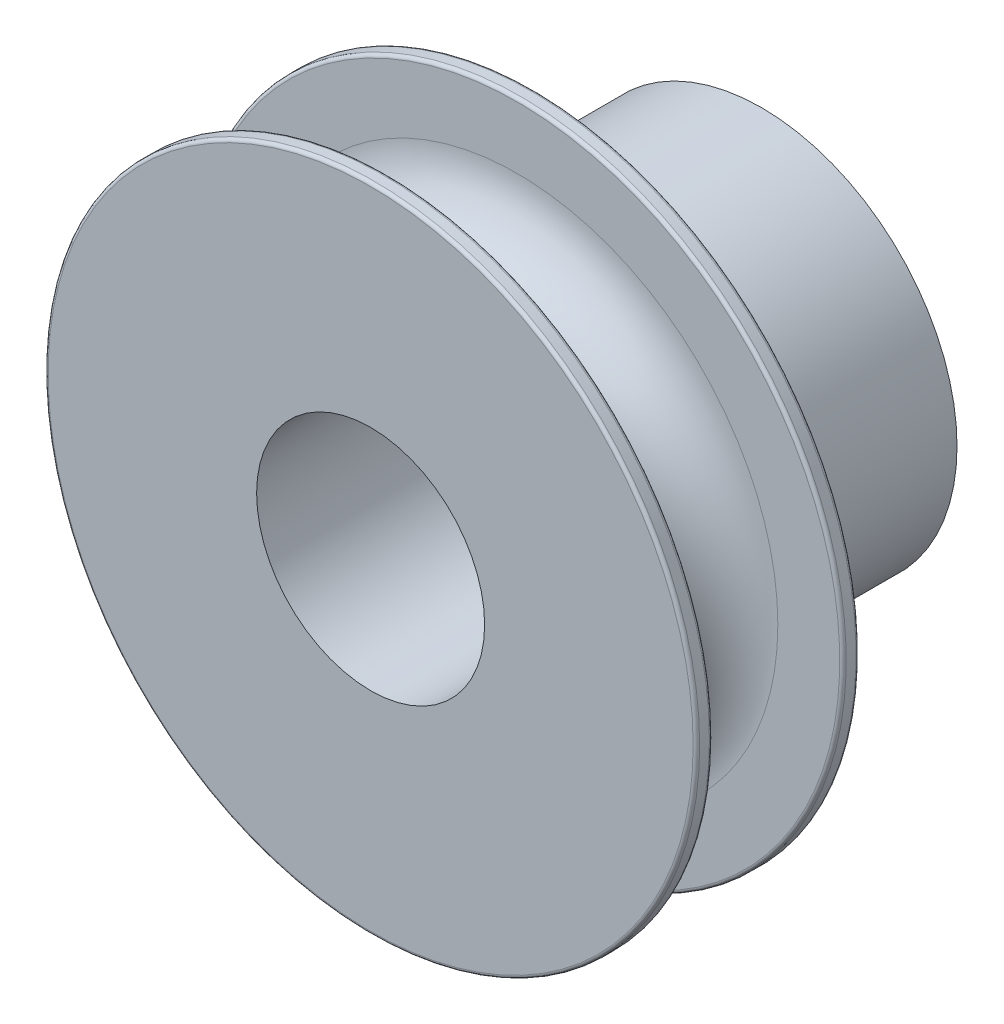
SolidWorks part; units mm, degrees
ref_plane "Front Plane" through (0, 0, 0) normal (0, 0, 1) x (1, 0, 0)
ref_plane "Top Plane" through (0, 0, 0) normal (0, 1, 0) x (1, 0, 0)
ref_plane "Right Plane" through (0, 0, 0) normal (1, 0, 0) x (0, 0, -1)
sketch "Sketch1" plane through (0, 0, 0) normal (0, 0, 1) x (1, 0, 0)
  line L0 (0, 0) -> (0, 19.05) construction
  line L1 (-6.1226, 21.2784) -> (6.1226, 16.8216) construction
  circle A0 centre (0, 0) radius 17.0656 construction
  circle A1 centre (0, 0) radius 20.6375 construction
  circle A2 centre (0, 0) radius 19.05 construction
  circle A3 centre (0, 0) radius 17.9011 construction
  point P8 (203.2, 0)
  point P13 (304.8, 0)
sketch "Sketch2" plane through (0, 0, 0) normal (1, 0, 0) x (0, 0, -1)
  line L0 (-152.4, 0) -> (152.4, 0) construction
  point P2 (-131.7625, 0)
  point P5 (-121.4438, 0)
  point P6 (131.7625, 0)
sketch "Sketch3" plane through (0, 0, 0) normal (0, 0, 1) x (1, 0, 0)
  circle A0 centre (0, 0) radius 20.6375
  circle A1 centre (0, 0) radius 20.6375 construction
extrude "Boss-Extrude1" add sketch "Sketch3" against normal up to vertex and the other way up to vertex
sketch "Sketch4" plane through (0, 0, 0) normal (0, 0, 1) x (1, 0, 0)
  line L0 (0, 0) -> (17.0438, 0.8622) construction
  line L2 (0, 0) -> (17.0438, -0.8622) construction
  line L4 (17.0438, 0.8622) -> (17.8783, 0.9044)
  line L5 (17.8783, -0.9044) -> (17.0438, -0.8622)
  arc A0 (17.0438, 0.8622) -> (17.0438, -0.8622) centre (0, 0) cw
  arc A3 (20.5273, 2.1297) -> (20.5273, -2.1297) centre (0, 0) cw
  circle A4 centre (0, 0) radius 20.6375 construction
  spline S0 degree 4 poles (17.8783, 0.9044) (17.8826, 0.9047) (17.8948, 0.9056) (17.9178, 0.908) (17.9552, 0.9129) (18.0028, 0.9204) (18.0642, 0.9316) (18.1363, 0.9468) (18.2153, 0.9656) (18.3009, 0.9883) (18.3861, 1.013) (18.4708, 1.0393) (18.5549, 1.0673) (18.6565, 1.1031) (18.7778, 1.1487) (18.9188, 1.2059) (19.0779, 1.2755) (19.2391, 1.3513) (19.3967, 1.43) (19.555, 1.5141) (19.7073, 1.5988) (19.8644, 1.6914) (20.0088, 1.7793) (20.1693, 1.883) (20.2983, 1.9682) (20.4671, 2.0861) (20.5663, 2.1574) (20.6818, 2.2427) (20.7328, 2.2815) (20.7642, 2.3054) knots 0 0 0 0 0 0.005377 0.015084 0.028532 0.04661 0.064855 0.092111 0.119476 0.146842 0.174209 0.201575 0.228941 0.256307 0.307035 0.361767 0.4165 0.471232 0.525964 0.580697 0.635429 0.690161 0.744894 0.799626 0.854358 0.909091 0.954545 1 1 1 1 1 construction
  spline S1 degree 4 poles (17.8783, 0.9044) (17.8826, 0.9047) (17.8948, 0.9056) (17.9178, 0.908) (17.9552, 0.9129) (18.0028, 0.9204) (18.0642, 0.9316) (18.1363, 0.9468) (18.2153, 0.9656) (18.3009, 0.9883) (18.3861, 1.013) (18.4708, 1.0393) (18.5549, 1.0673) (18.6565, 1.1031) (18.7778, 1.1487) (18.9188, 1.2059) (19.0779, 1.2755) (19.2391, 1.3513) (19.3967, 1.43) (19.555, 1.5141) (19.7073, 1.5988) (19.8644, 1.6914) (20.0088, 1.7793) (20.1693, 1.883) (20.2983, 1.9682) (20.4305, 2.0606) (20.4946, 2.1061) (20.5273, 2.1297) knots 0 0 0 0 0 0.005377 0.015084 0.028532 0.04661 0.064855 0.092111 0.119476 0.146842 0.174209 0.201575 0.228941 0.256307 0.307035 0.361767 0.4165 0.471232 0.525964 0.580697 0.635429 0.690161 0.744894 0.799626 0.854358 0.909091 0.909091 0.909091 0.909091 0.909091
  spline S2 degree 4 poles (17.8783, -0.9044) (17.8826, -0.9047) (17.8948, -0.9056) (17.9178, -0.908) (17.9552, -0.9129) (18.0028, -0.9204) (18.0642, -0.9316) (18.1363, -0.9468) (18.2153, -0.9656) (18.3009, -0.9883) (18.3861, -1.013) (18.4708, -1.0393) (18.5549, -1.0673) (18.6565, -1.1031) (18.7778, -1.1487) (18.9188, -1.2059) (19.0779, -1.2755) (19.2391, -1.3513) (19.3967, -1.43) (19.555, -1.5141) (19.7073, -1.5988) (19.8644, -1.6914) (20.0088, -1.7793) (20.1693, -1.883) (20.2983, -1.9682) (20.4671, -2.0861) (20.5663, -2.1574) (20.6818, -2.2427) (20.7328, -2.2815) (20.7642, -2.3054) knots 0 0 0 0 0 0.005377 0.015084 0.028532 0.04661 0.064855 0.092111 0.119476 0.146842 0.174209 0.201575 0.228941 0.256307 0.307035 0.361767 0.4165 0.471232 0.525964 0.580697 0.635429 0.690161 0.744894 0.799626 0.854358 0.909091 0.954545 1 1 1 1 1 construction
  spline S3 degree 4 poles (17.8783, -0.9044) (17.8826, -0.9047) (17.8948, -0.9056) (17.9178, -0.908) (17.9552, -0.9129) (18.0028, -0.9204) (18.0642, -0.9316) (18.1363, -0.9468) (18.2153, -0.9656) (18.3009, -0.9883) (18.3861, -1.013) (18.4708, -1.0393) (18.5549, -1.0673) (18.6565, -1.1031) (18.7778, -1.1487) (18.9188, -1.2059) (19.0779, -1.2755) (19.2391, -1.3513) (19.3967, -1.43) (19.555, -1.5141) (19.7073, -1.5988) (19.8644, -1.6914) (20.0088, -1.7793) (20.1693, -1.883) (20.2983, -1.9682) (20.4305, -2.0606) (20.4946, -2.1061) (20.5273, -2.1297) knots 0 0 0 0 0 0.005377 0.015084 0.028532 0.04661 0.064855 0.092111 0.119476 0.146842 0.174209 0.201575 0.228941 0.256307 0.307035 0.361767 0.4165 0.471232 0.525964 0.580697 0.635429 0.690161 0.744894 0.799626 0.854358 0.909091 0.909091 0.909091 0.909091 0.909091
extrude "Cut-Extrude1" cut sketch "Sketch4" against normal through all both and the other way through all
fillet "Fillet1" radius 0.5326 2 edges at (17.0438, -0.8622, 0) (17.0438, 0.8622, 0)
pattern_circular "CirPattern1" count 24 over 360 about axis through (0, 0, 152.4) along (0, 0, -1) of "Cut-Extrude1", "Fillet1"
sketch "Sketch6" plane through (0, 0, 152.4) normal (0, 0, 1) x (1, 0, 0)
  circle A0 centre (-38.1, 0) radius 673.6155
  circle A1 centre (0, 0) radius 38.1 construction
extrude "Cut-Extrude2" cut sketch "Sketch6" against normal blind 177.8
sketch "Sketch7" plane through (0, 0, -25.4) normal (0, 0, 1) x (1, 0, 0)
  circle A0 centre (0, 0) radius 22.225
  circle A1 centre (0, 0) radius 38.1
  dimension "D1" = 76.2
  dimension "D2" = 44.45
extrude "Boss-Extrude2" add sketch "Sketch7" against normal blind 76.2 separate body
sketch "Sketch8" plane through (0, 0, -25.4) normal (0, 0, 1) x (1, 0, 0)
  circle A0 centre (0, 0) radius 38.1 construction
  circle A1 centre (0, 0) radius 38.1
  circle A2 centre (0, 0) radius 63.5
  dimension "D1" = 25.4
extrude "Boss-Extrude3" add sketch "Sketch8" against normal blind 3.175
ref_plane "Plane1" through (0, 0, -41.275) normal (0, 0, 1) x (1, 0, 0)
mirror "Mirror2" about plane through (0, 0, -41.275) normal (0, 0, 1) of "Boss-Extrude3"
fillet "Fillet2" radius 12.7 3 edges at (38.1, 0, -53.975) (-38.1, 0, -57.15) (38.1, 0, -28.575)
fillet "Fillet3" radius 0.635 4 edges at (63.5, 0, -28.575) (63.5, 0, -53.975) (63.5, 0, -57.15) (63.5, 0, -25.4)
sketch "Sketch9" plane through (0, 0, -25.4) normal (0, 0, 1) x (1, 0, 0)
  circle A0 centre (0, 0) radius 22.225 construction
  circle A1 centre (0, 0) radius 22.225
  circle A2 centre (0, 0) radius 63.5 construction
  circle A3 centre (0, 0) radius 63.5
extrude "Cut-Extrude3" cut sketch "Sketch9" against normal through all contours M2
ref_plane "Plane3" through (0, 0, -82.55) normal (0, 0, -1) x (-1, 0, 0)
sketch "Sketch12" plane through (0, 0, -82.55) normal (0, 0, -1) x (-1, 0, 0)
  line L0 (0, 0) -> (0, 38.1)
  line L2 (-6.35, 25.1245) -> (6.35, 25.1245)
  line L3 (-6.35, 25.1245) -> (-6.35, 37.5671)
  line L4 (-6.35, 37.5671) -> (6.35, 37.5671)
  line L5 (6.35, 25.1245) -> (6.35, 37.5671)
  line L6 (-6.35, 25.1245) -> (6.35, 37.5671) construction
  line L7 (-6.35, 37.5671) -> (6.35, 25.1245) construction
  line L8 (-6.35, 37.5671) -> (6.35, 37.5671)
  line L9 (-6.35, 37.5671) -> (-6.35, 41.5051)
  line L10 (-6.35, 41.5051) -> (6.35, 41.5051)
  line L11 (6.35, 37.5671) -> (6.35, 41.5051)
  line L12 (-6.35, 37.5671) -> (6.35, 41.5051) construction
  line L13 (-6.35, 41.5051) -> (6.35, 37.5671) construction
  line L14 (-2.6274, 15.5954) -> (2.6274, 15.5954)
  line L15 (-2.6274, 15.5954) -> (-2.6274, 25.1245)
  line L16 (-2.6274, 25.1245) -> (2.6274, 25.1245)
  line L17 (2.6274, 15.5954) -> (2.6274, 25.1245)
  line L18 (-2.6274, 15.5954) -> (2.6274, 25.1245) construction
  line L19 (-2.6274, 25.1245) -> (2.6274, 15.5954) construction
  circle A0 centre (0, 0) radius 38.1 construction
  point P6 (0, 31.3458)
  point P13 (0, 39.5361)
  point P14 (0, 20.3599)
  dimension "D1" = 12.7
equation "\"Root Diameter@Sketch1\"=\"Root Diameter\""
equation "\"OD | Outside Diameter@Sketch1\"=\"Outside Diameter\""
equation "\"D1@CirPattern1\"=\"Number of Teeth\""
equation "\"Diametral Pitch\"= 16"
equation "\"Number of Teeth\"= 24"
equation "\"Pressure Angle\"=20"
equation "\"Pitch Diameter\"= \"Number of Teeth\" / \"Diametral Pitch\""
equation "\"Base Diameter\"= \"Pitch Diameter\" * cos ( \"Pressure Angle\" )"
equation "\"Outside Diameter\"= ( \"Number of Teeth\" + 2 ) / \"Diametral Pitch\""
equation "\"Dedendum\"= 1.25 / \"Diametral Pitch\""
equation "\"Root Diameter\"= \"Pitch Diameter\" - ( 2 * \"Dedendum\" )"
equation "\"Pitch Angle\"= 360deg / \"Number of Teeth\""
equation "\"Alpha\"= sqr ( \"Pitch Diameter\" ^ 2 - \"Base Diameter\" ^ 2 ) / \"Base Diameter\" * 180 / PI - \"Pressure Angle\""
equation "\"Beta\"= ( \"Pitch Angle\" / 4 - \"Alpha\" )"
equation "\"Phi\"= sqr ( ( \"Outside Diameter\" / 2 ) ^ 2 - ( \"Base Diameter\" / 2 ) ^ 2 ) / ( \"Base Diameter\" / 2 )"
equation "\"Addendum\"= 1 / \"Diametral Pitch\""
equation "\"WorkingDepth\"= 2 / \"Diametral Pitch\""
equation "\"WholeDepth\"= 2.25 / \"Diametral Pitch\""
equation "\"Clearance\"= 0.25 / \"Diametral Pitch\""
equation "\"ToothThickness\"= ( pi * 2 ) / \"Diametral Pitch\""
equation "\"CircularPitch\"= pi / \"Diametral Pitch\""
equation "\"Number of Teeth@Sketch1\"=\"Number of Teeth\""
equation "\"Gear Pitch | Diametral Pitch@Sketch1\"=\"Diametral Pitch\""
equation "\"Pressure Angle@Sketch1\"=\"Pressure Angle\""
equation "\"Gear Pitch Diameter@Sketch1\"=\"Pitch Diameter\""
equation "\"Base Diameter@Sketch1\"=\"Base Diameter\""
equation "\"Fillet\"= \"Clearance\" * cos ( \"Pressure Angle\" ) * tan ( ( 90 + \"Pressure Angle\" ) / 2 )"
equation "\"D1@Fillet1\"=\"Fillet\""
equation "\"D1@Sketch4\"=if( \"Base Diameter\">\"Root Diameter\",\"Root Diameter\",\"Base Diameter\"-.00001)"
equation "\"D1@Sketch2\"=\"OD | Outside Diameter@Sketch1\"*2*0.5*0.5"
equation "\"D2@Sketch2\"=\"D1@Sketch2\"*1.5"
equation "\"D3@Sketch2\"=\"D1@Sketch2\""
